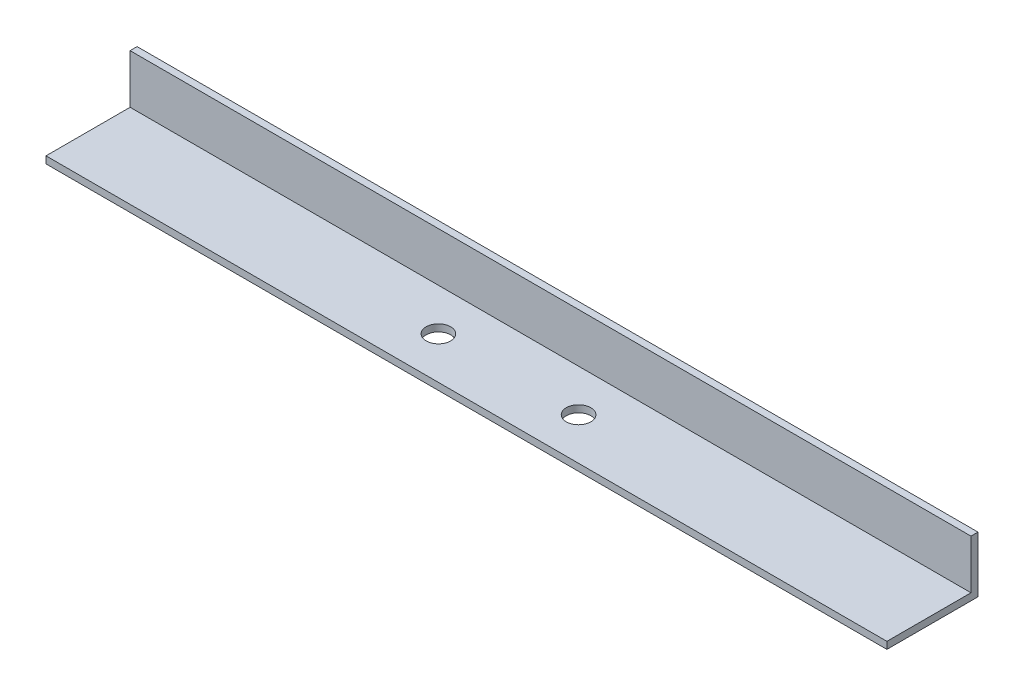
SolidWorks part; units mm, degrees
ref_plane "Front Plane" through (0, 0, 0) normal (0, 0, 1) x (1, 0, 0)
ref_plane "Top Plane" through (0, 0, 0) normal (0, 1, 0) x (1, 0, 0)
ref_plane "Right Plane" through (0, 0, 0) normal (1, 0, 0) x (0, 0, -1)
sketch "Sketch1" plane through (0, 0, 0) normal (0, 0, 1) x (1, 0, 0)
  line L1 (0, 0) -> (120, 0)
  line L2 (0, 0) -> (0, 8)
  line L3 (0, 8) -> (120, 8)
  line L4 (120, 0) -> (120, 8)
  dimension "D1" = 8
  dimension "D2" = 120
extrude "Boss-Extrude1" add sketch "Sketch1" along normal blind 13
sketch "Sketch2" plane through (0, 0, 0) normal (-1, 0, 0) x (0, 0, 1)
  line L0 (0, 8) -> (0, 0) construction
  line L1 (13, 8) -> (1, 8)
  line L2 (13, 8) -> (13, 1)
  line L3 (13, 1) -> (1, 1)
  line L4 (1, 8) -> (1, 1)
  line L5 (13, 0) -> (0, 0) construction
  dimension "D1" = 1
  dimension "D2" = 1
extrude "Cut-Extrude1" cut sketch "Sketch2" against normal through all
sketch "Sketch3" plane through (0, 0, 0) normal (0, -1, 0) x (1, 0, 0)
  line L2 (0, 13) -> (0, 0) construction
  line L5 (0, 0) -> (120, 0) construction
  circle A0 centre (50, 7) radius 1.75
  circle A1 centre (70, 7) radius 1.75
  dimension "D1" = 3.5
  dimension "D2" = 3.5
  dimension "D3" = 50
  dimension "D4" = 7
  dimension "D5" = 20
extrude "Cut-Extrude2" cut sketch "Sketch3" against normal blind 10
